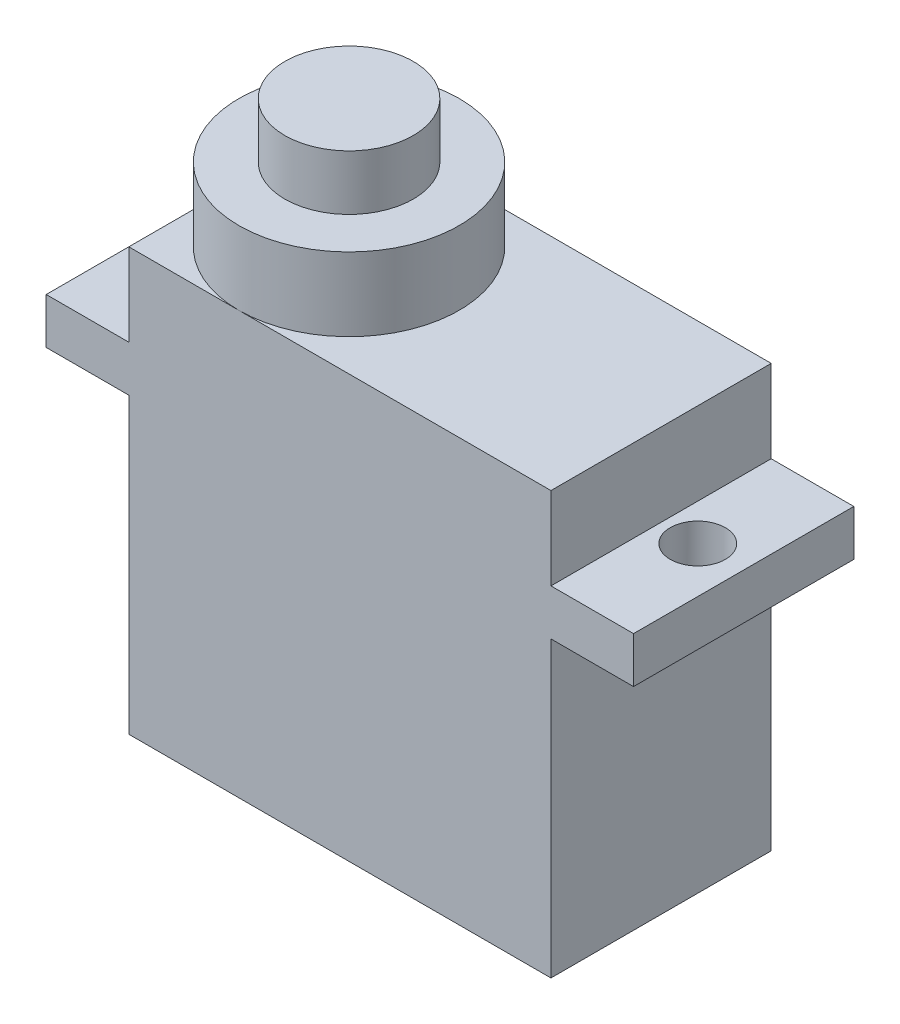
SolidWorks part; units mm, degrees
ref_plane "Front Plane" through (0, 0, 0) normal (0, 0, 1) x (1, 0, 0)
ref_plane "Top Plane" through (0, 0, 0) normal (0, 1, 0) x (1, 0, 0)
ref_plane "Right Plane" through (0, 0, 0) normal (1, 0, 0) x (0, 0, -1)
sketch "Sketch1" plane through (0, 0, 0) normal (0, 1, 0) x (1, 0, 0)
  line L1 (0, 0) -> (32, 0)
  line L2 (0, 0) -> (0, 12)
  line L3 (0, 12) -> (32, 12)
  line L4 (32, 0) -> (32, 12)
  dimension "D1" = 32
  dimension "D2" = 12
extrude "Boss-Extrude1" add sketch "Sketch1" along normal blind 23
sketch "Sketch2" plane through (0, 0, 0) normal (0, 0, 1) x (1, 0, 0)
  line L1 (0, 0) -> (4.5, 0)
  line L2 (0, 0) -> (0, 16)
  line L3 (0, 16) -> (4.5, 16)
  line L4 (4.5, 0) -> (4.5, 16)
  line L5 (0, 23) -> (4.5, 23)
  line L6 (0, 23) -> (0, 18.5)
  line L7 (0, 18.5) -> (4.5, 18.5)
  line L8 (4.5, 23) -> (4.5, 18.5)
  line L9 (32, 23) -> (27.5, 23)
  line L10 (32, 23) -> (32, 18.5)
  line L11 (32, 18.5) -> (27.5, 18.5)
  line L12 (27.5, 23) -> (27.5, 18.5)
  line L13 (32, 0) -> (27.5, 0)
  line L14 (32, 0) -> (32, 16)
  line L15 (32, 16) -> (27.5, 16)
  line L16 (27.5, 0) -> (27.5, 16)
  dimension "D1" = 4.5
  dimension "D2" = 4.5
  dimension "D3" = 4.5
  dimension "D4" = 4.5
  dimension "D5" = 16
  dimension "D6" = 16
  dimension "D7" = 2.5
  dimension "D8" = 2.5
extrude "Cut-Extrude1" cut sketch "Sketch2" against normal blind 23
sketch "Sketch3" plane through (0, 18.5, 0) normal (0, 1, 0) x (1, 0, 0)
  line L0 (4.5, 12) -> (4.5, 0) construction
  line L1 (27.5, 0) -> (27.5, 12) construction
  circle A0 centre (2.5, 6) radius 1.5
  circle A1 centre (29.5, 6) radius 1.5
  dimension "D1" = 3
  dimension "D4" = 3
  dimension "D2" = 2
  dimension "D3" = 2
extrude "Cut-Extrude2" cut sketch "Sketch3" against normal blind 23
sketch "Sketch4" plane through (0, 23, 0) normal (0, 1, 0) x (1, 0, 0)
  line L0 (4.5, 12) -> (4.5, 0) construction
  circle A0 centre (10.5, 6) radius 6
extrude "Boss-Extrude2" add sketch "Sketch4" along normal blind 4
sketch "Sketch5" plane through (0, 27, 0) normal (0, 1, 0) x (1, 0, 0)
  circle A0 centre (10.5, 6) radius 3.5
  dimension "D1" = 7
extrude "Boss-Extrude3" add sketch "Sketch5" along normal blind 3
